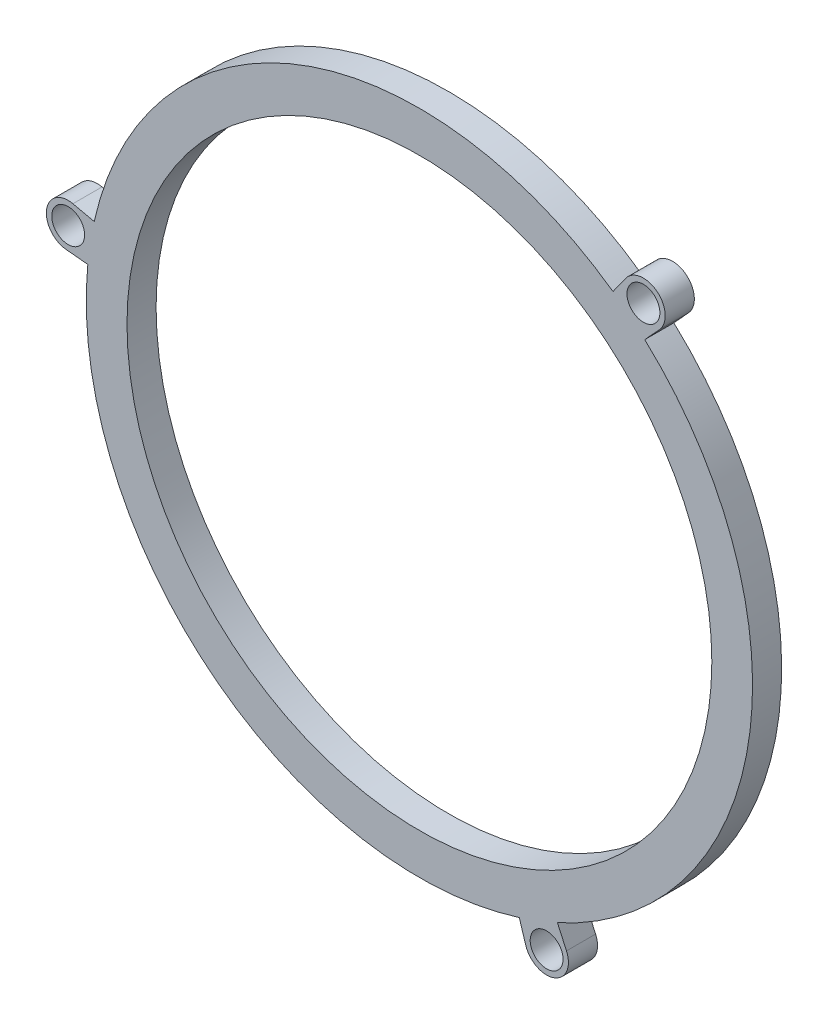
SolidWorks part; units mm, degrees
ref_plane "Front Plane" through (0, 0, 0) normal (0, 0, 1) x (1, 0, 0)
ref_plane "Top Plane" through (0, 0, 0) normal (0, 1, 0) x (1, 0, 0)
ref_plane "Right Plane" through (0, 0, 0) normal (1, 0, 0) x (0, 0, -1)
sketch "Sketch1" plane through (0, 0, 0) normal (0, 0, 1) x (1, 0, 0)
  line L0 (-19.2733, 19.2846) -> (-21.1327, 19.6988)
  line L1 (-19.8341, 15.7599) -> (-21.7303, 15.9433)
  line L2 (26.0119, 36.631) -> (27.1188, 38.1814)
  line L3 (28.784, 34.3829) -> (30.0724, 35.7861)
  line L4 (17.8309, -14.7851) -> (18.4019, -16.6025)
  line L5 (21.1638, -13.5084) -> (21.9531, -15.2422)
  circle A0 centre (9.1138, 12.9608) radius 29.083
  circle A1 centre (9.1138, 12.9608) radius 25.527
  arc A2 (-21.1327, 19.6988) -> (-21.7303, 15.9433) centre (-21.547, 17.8394) ccw
  arc A3 (27.1188, 38.1814) -> (30.0724, 35.7861) centre (28.6692, 37.0746) cw
  arc A4 (18.4019, -16.6025) -> (21.9531, -15.2422) centre (20.2193, -16.0315) ccw
  circle A5 centre (28.6692, 37.0746) radius 1.4351
  circle A6 centre (-21.547, 17.8394) radius 1.4351
  circle A7 centre (20.2193, -16.0315) radius 1.4351
  dimension "D1" = 1.905
  dimension "D2" = 120
  dimension "D3" = 1.905
  dimension "D6" = 1.905
  dimension "D9" = 1.905
  dimension "D8" = 51.054
  dimension "D10" = 58.166
  dimension "D11" = 2.8702
  dimension "D12" = 2.8702
  dimension "D13" = 2.8702
  dimension "D4" = 1.905
  dimension "D5" = 120
  dimension "D7" = 1.905
extrude "Extrude1" add sketch "Sketch1" along normal blind 2.54
